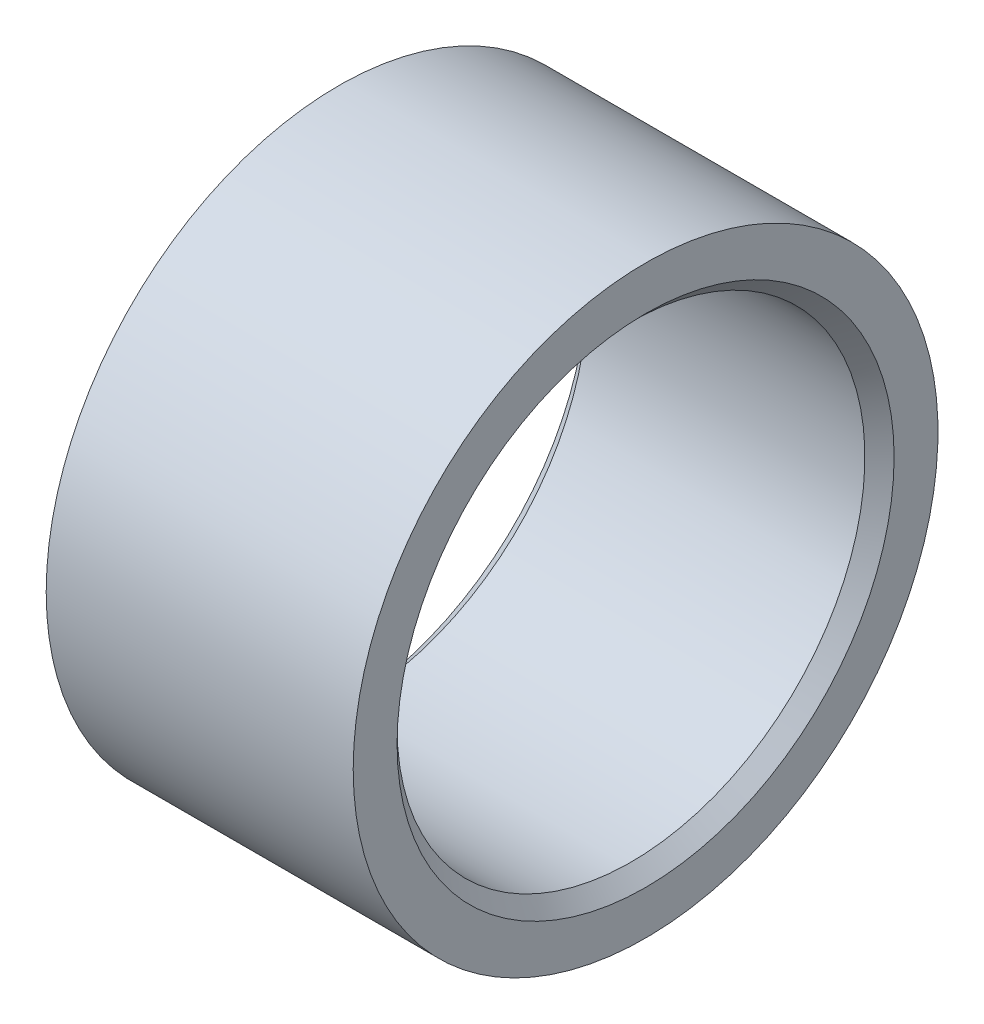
SolidWorks part; units mm, degrees
ref_plane "前视基准面" through (0, 0, 0) normal (0, 0, 1) x (1, 0, 0)
ref_plane "上视基准面" through (0, 0, 0) normal (0, 1, 0) x (1, 0, 0)
ref_plane "右视基准面" through (0, 0, 0) normal (1, 0, 0) x (0, 0, -1)
other "Configuration Table"
sketch "草图2" plane through (0, 0, 0) normal (0, 0, 1) x (1, 0, 0)
  line L0 (0, 0) -> (125.0714, 0) construction
  line L2 (0, 0) -> (21, 0)
  line L3 (0, 0) -> (0, 20)
  line L4 (0, 20) -> (21, 20)
  line L5 (21, 0) -> (21, 20)
  line L6 (0, 0) -> (21, 0)
  line L7 (0, 0) -> (0, 16)
  line L8 (0, 16) -> (21, 16)
  line L9 (21, 0) -> (21, 16)
  point P10 (21, 8)
  dimension "D1" = 21
  dimension "D2" = 20
  dimension "D3" = 21
  dimension "D4" = 0
  dimension "D5" = 16
revolve "旋转4" add sketch "草图2" angle 360 about L0
chamfer "倒角1" distance 1 2 edges at (0, 0, 16) (21, 0, 16)
